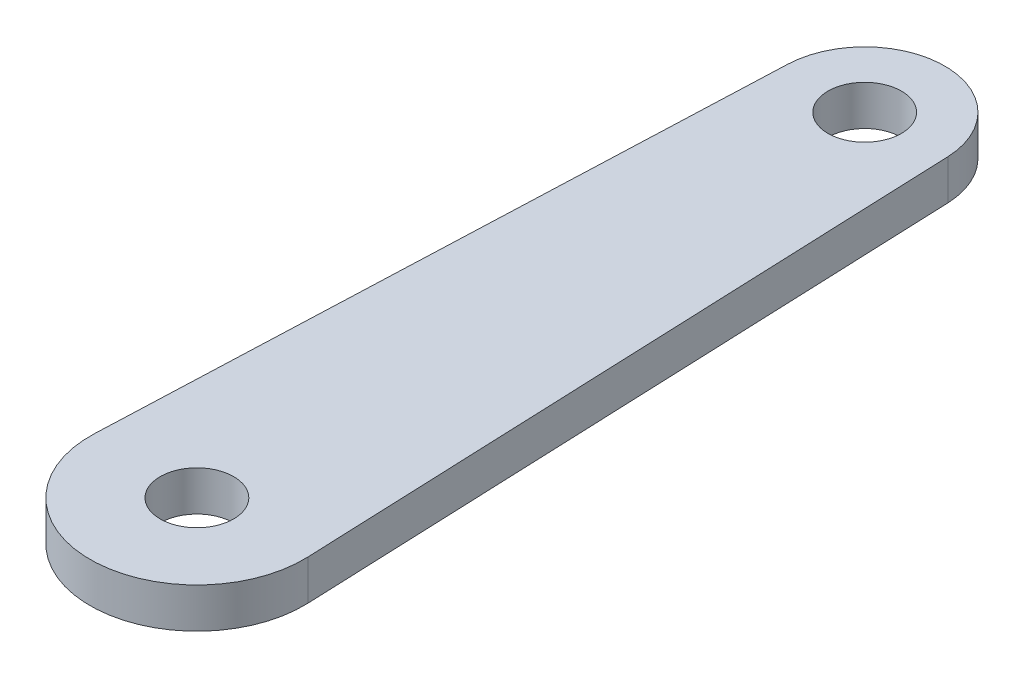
SolidWorks part; units mm, degrees
ref_plane "Front" through (0, 0, 0) normal (0, 0, 1) x (1, 0, 0)
ref_plane "Top" through (0, 0, 0) normal (0, 1, 0) x (1, 0, 0)
ref_plane "Right" through (0, 0, 0) normal (1, 0, 0) x (0, 0, -1)
sketch "Sketch1" plane through (0, 0, 0) normal (0, 1, 0) x (1, 0, 0)
  line L1 (5.9952, 50.24) -> (7.9936, 0.32)
  line L2 (-5.9952, 50.24) -> (-7.9936, 0.32)
  circle A0 centre (0, 50) radius 2.75
  circle A1 centre (0, 0) radius 2.75
  arc A2 (5.9952, 50.24) -> (-5.9952, 50.24) centre (0, 50) ccw
  arc A3 (-7.9936, 0.32) -> (7.9936, 0.32) centre (0, 0) ccw
extrude "Extrude1" add sketch "Sketch1" along normal blind 3
